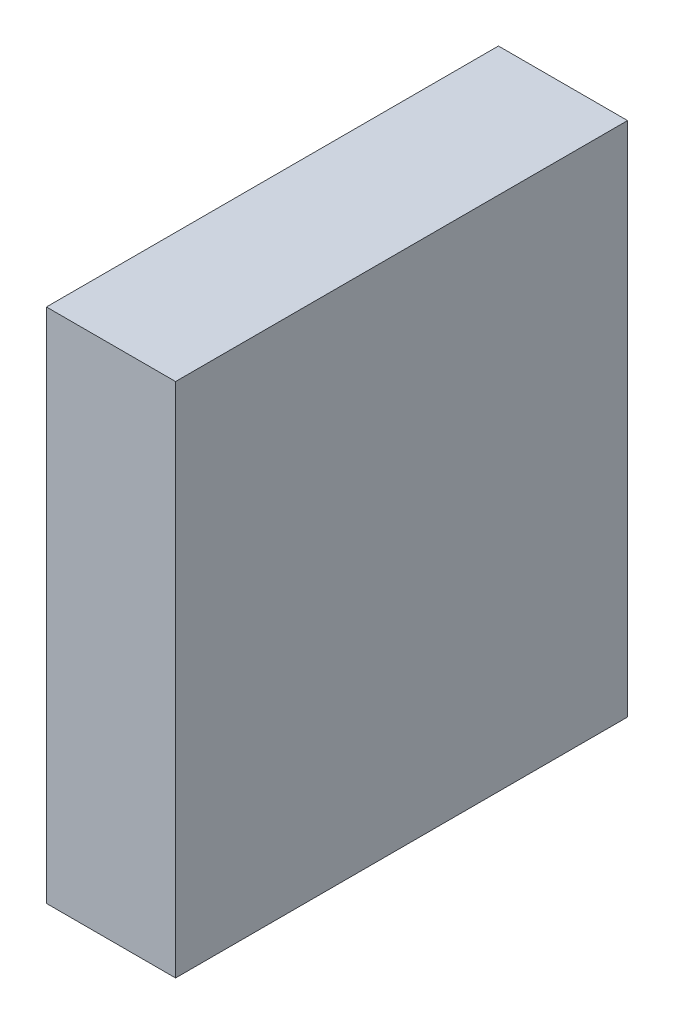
SolidWorks part; units mm, degrees
ref_plane "Alzado" through (0, 0, 0) normal (0, 0, 1) x (1, 0, 0)
ref_plane "Planta" through (0, 0, 0) normal (0, 1, 0) x (1, 0, 0)
ref_plane "Vista lateral" through (0, 0, 0) normal (1, 0, 0) x (0, 0, -1)
sketch "Croquis1" plane through (0, 0, 0) normal (0, 0, 1) x (1, 0, 0)
  line L1 (0, 0) -> (2, 0)
  line L2 (0, 0) -> (0, 8)
  line L3 (0, 8) -> (2, 8)
  line L4 (2, 0) -> (2, 8)
  dimension "D1" = 2
  dimension "D2" = 8
extrude "Saliente-Extruir1" add sketch "Croquis1" along normal blind 7
